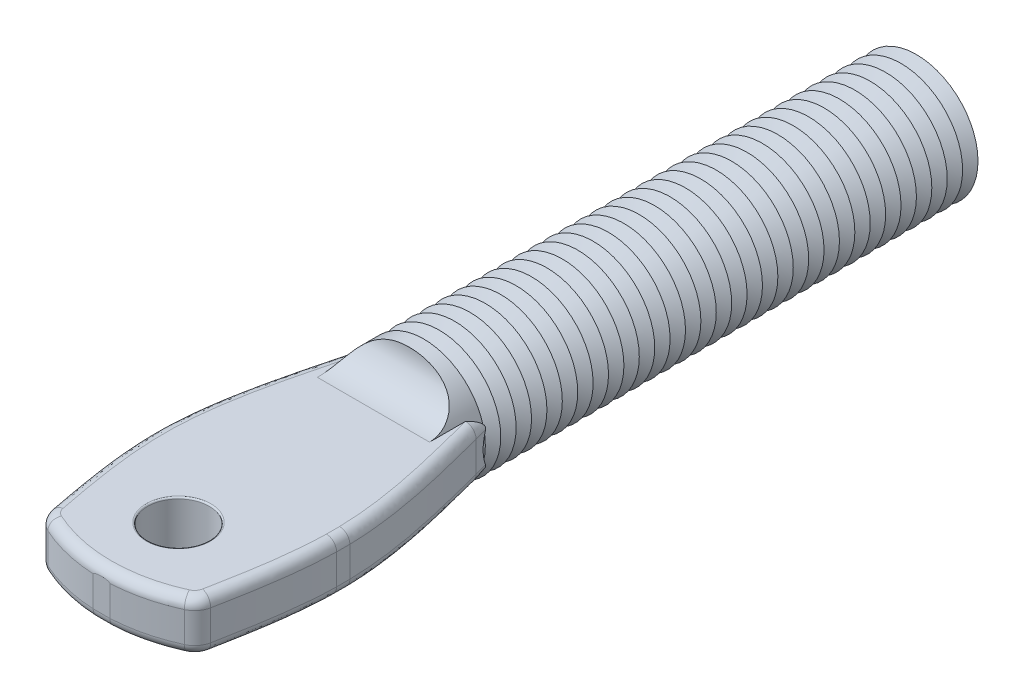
SolidWorks part; units mm, degrees
ref_plane "Front Plane" through (0, 0, 0) normal (0, 0, 1) x (1, 0, 0)
ref_plane "Top Plane" through (0, 0, 0) normal (0, 1, 0) x (1, 0, 0)
ref_plane "Right Plane" through (0, 0, 0) normal (1, 0, 0) x (0, 0, -1)
sketch "Sketch1" plane through (0, 0, 0) normal (0, 1, 0) x (1, 0, 0)
  line L0 (-9.2, 15) -> (9.2, -15) construction
  line L1 (-9.2, 15) -> (9.2, 15)
  line L2 (-9.2, 15) -> (-9.2, -15)
  line L3 (-9.2, -15) -> (9.2, -15)
  line L4 (9.2, 15) -> (9.2, -15)
  dimension "D1" = 18.4
  dimension "D2" = 30
extrude "Boss-Extrude1" add sketch "Sketch1" along normal blind 4.95
sketch "Sketch2" plane through (0, 4.95, 0) normal (0, 1, 0) x (1, 0, 0)
  line L0 (0, 15) -> (0, -15) construction
  line L1 (9.2, 15) -> (-9.2, 15) construction
  line L2 (-9.2, -15) -> (9.2, -15) construction
  line L3 (11.4859, -15) -> (7.225, -15)
  line L4 (-9.2, 15) -> (-9.2, -15) construction
  line L5 (-6.5, 15) -> (-11.4859, 15)
  line L6 (-11.4859, 15) -> (-11.4859, -15)
  line L7 (-11.4859, -15) -> (-7.225, -15)
  line L8 (11.4859, 15) -> (11.4859, -15)
  line L9 (6.5, 15) -> (11.4859, 15)
  spline S0 degree 3 poles (-6.5, 15) (-7.7391, 10.1392) (-10.4438, 0.0554) (-8.1698, -10.087) (-7.225, -15) knots 0 0 0 0 0.502016 1 1 1 1
  spline S1 degree 3 poles (6.5, 15) (7.7391, 10.1392) (10.4438, 0.0554) (8.1698, -10.087) (7.225, -15) knots 0 0 0 0 0.502016 1 1 1 1
extrude "Cut-Extrude1" cut sketch "Sketch2" against normal blind 4.95
sketch "Sketch3" plane through (0, 4.95, 0) normal (0, 1, 0) x (1, 0, 0)
  line L0 (-7.5936, -13.1091) -> (-7.5936, -16.4029)
  line L1 (-7.5936, -16.4029) -> (7.5936, -16.4029)
  line L2 (7.5936, -16.4029) -> (7.5936, -13.1091)
  arc A0 (-7.5936, -13.1091) -> (7.5936, -13.1091) centre (0, 1.0202) ccw
  spline S0 degree 3 poles (-7.225, -15) (-8.0889, -10.5076) (-9.1097, -5.9001) (-9.2, -1.2938) knots 0 0 0 0 0.455349 0.455349 0.455349 0.455349 construction
  spline S1 degree 3 poles (9.2, -1.2938) (9.1097, -5.9001) (8.0889, -10.5076) (7.225, -15) knots 0.544651 0.544651 0.544651 0.544651 1 1 1 1 construction
extrude "Cut-Extrude2" cut sketch "Sketch3" against normal blind 4.95
sketch "Sketch4" plane through (0, 0, -15) normal (0, 0, -1) x (-1, 0, 0)
  line L0 (0, 4.95) -> (0, 0) construction
  line L1 (-6.5, 4.95) -> (6.5, 4.95) construction
  circle A0 centre (0, 2.475) radius 6
  dimension "D1" = 12
extrude "Boss-Extrude2" add sketch "Sketch4" along normal blind 50
fillet "Fillet1" radius 1 8 edges at (4.3059, 0, 14.4316) (4.3059, 4.95, 14.4316)
fillet "Fillet2" radius 2 6 edges at (7.429, 4.5295, 12.9873) (7.429, 0.4205, 12.9873) (-7.333, 4.6571, 12.916) (-7.429, 0.4205, 12.9873) (-7.5936, 2.475, 13.1091) (7.5936, 2.475, 13.1091)
sketch "Sketch9" plane through (0, 0, -15) normal (0, 0, -1) x (-1, 0, 0)
  line L3 (5.4657, 0) -> (5.468, 0)
  line L4 (6.5, 1) -> (6.5, 3.95)
  line L5 (5.468, 4.95) -> (5.4657, 4.95)
  line L6 (5.4657, 0) -> (5.468, 0)
  line L7 (6.5, 1) -> (6.5, 3.95)
  line L8 (5.468, 4.95) -> (5.4657, 4.95)
  arc A1 (5.4657, 0) -> (5.4657, 4.95) centre (0, 2.475) ccw
  arc A2 (5.4657, 0) -> (5.4657, 4.95) centre (0, 2.475) ccw
  spline S2 degree 3 poles (2769.8589, 1152.2258) (-69.6047, 166.6854) (-4.7349, -4.1112) (5.9817, 0.123) (6.0956, 0.1955) (12.667, 6.4591) (-67.2021, 101.1798) (-1766.1792, -2416.4243) knots -21.101957 -21.101957 -21.101957 -21.101957 0.25 0.25 0.5 0.5 17.347125 17.347125 17.347125 17.347125 only from (5.468, 0) to (6.5, 1)
  spline S3 degree 3 poles (-1416.5643, 2641.4156) (-117.4769, -64.9249) (10.2527, -4.4883) (6.3662, 4.4598) (6.288, 4.571) (6.0965, 4.7538) (5.9816, 4.8269) (-2.4912, 8.1829) (-58.0534, -95.05) (2803.1848, -1072.1812) knots -17.84645 -17.84645 -17.84645 -17.84645 0.25 0.25 0.5 0.5 0.75 0.75 17.711935 17.711935 17.711935 17.711935 only from (6.5, 3.95) to (5.468, 4.95)
  spline S4 degree 3 poles (5.468, 0) (5.6022, 0) (5.7336, 0.025) (5.9817, 0.123) (6.0956, 0.1955) (6.3839, 0.4703) (6.5, 0.7314) (6.5, 1) knots 0 0 0 0 0.25 0.25 0.5 0.5 1 1 1 1
  spline S5 degree 3 poles (6.5, 3.95) (6.5, 4.0842) (6.4721, 4.216) (6.3662, 4.4598) (6.288, 4.571) (6.0965, 4.7538) (5.9816, 4.8269) (5.7354, 4.9244) (5.6021, 4.95) (5.468, 4.95) knots 0 0 0 0 0.25 0.25 0.5 0.5 0.75 0.75 1 1 1 1
  dimension "D1" = 0
extrude "Boss-Extrude3" add sketch "Sketch9" along normal blind 1.5 draft 15 separate body
sketch "Sketch10" plane through (0, 0, -15) normal (0, 0, -1) x (-1, 0, 0)
  line L3 (-5.4657, 4.95) -> (-5.468, 4.95)
  line L4 (-6.5, 3.95) -> (-6.5, 1)
  line L5 (-5.468, 0) -> (-5.4657, 0)
  line L6 (-5.4657, 4.95) -> (-5.468, 4.95)
  line L7 (-6.5, 3.95) -> (-6.5, 1)
  line L8 (-5.468, 0) -> (-5.4657, 0)
  arc A1 (-5.4657, 4.95) -> (-5.4657, 0) centre (0, 2.475) ccw
  arc A2 (-5.4657, 4.95) -> (-5.4657, 0) centre (0, 2.475) ccw
  spline S2 degree 3 poles (-2769.8589, -1147.2758) (69.6047, -161.7354) (4.7349, 9.0612) (-5.9817, 4.827) (-6.0956, 4.7545) (-12.667, -1.5091) (67.2021, -96.2298) (1766.1792, 2421.3743) knots -21.101957 -21.101957 -21.101957 -21.101957 0.25 0.25 0.5 0.5 17.347125 17.347125 17.347125 17.347125 only from (-5.468, 4.95) to (-6.5, 3.95)
  spline S3 degree 3 poles (1416.5643, -2636.4656) (117.4769, 69.8749) (-10.2527, 9.4383) (-6.3662, 0.4902) (-6.288, 0.379) (-6.0965, 0.1962) (-5.9816, 0.1231) (2.4912, -3.2329) (58.0534, 100) (-2803.1848, 1077.1312) knots -17.84645 -17.84645 -17.84645 -17.84645 0.25 0.25 0.5 0.5 0.75 0.75 17.711935 17.711935 17.711935 17.711935 only from (-6.5, 1) to (-5.468, 0)
  spline S4 degree 3 poles (-5.468, 4.95) (-5.6022, 4.95) (-5.7336, 4.925) (-5.9817, 4.827) (-6.0956, 4.7545) (-6.3839, 4.4797) (-6.5, 4.2186) (-6.5, 3.95) knots 0 0 0 0 0.25 0.25 0.5 0.5 1 1 1 1
  spline S5 degree 3 poles (-6.5, 1) (-6.5, 0.8658) (-6.4721, 0.734) (-6.3662, 0.4902) (-6.288, 0.379) (-6.0965, 0.1962) (-5.9816, 0.1231) (-5.7354, 0.0256) (-5.6021, 0) (-5.468, 0) knots 0 0 0 0 0.25 0.25 0.5 0.5 0.75 0.75 1 1 1 1
  dimension "D1" = 0
extrude "Boss-Extrude4" add sketch "Sketch10" along normal blind 1.5 draft 15
fillet "Fillet3" radius 3.5 2 edges
sketch "Sketch6" plane through (0, 0, 0) normal (1, 0, 0) x (0, 0, -1)
  line L0 (15, 2.475) -> (23.9396, 2.475) construction
  line L1 (15, 0) -> (15, 4.95) construction
  line L2 (16.4, 8.475) -> (17.9, 8.475)
  line L4 (65, 8.475) -> (15, 8.475) construction
  line L5 (17.9, 8.475) -> (17.15, 7.3697)
  line L6 (17.15, 7.3697) -> (16.4, 8.475)
  dimension "D1" = 1.5
  dimension "D2" = 1.4
revolve "Cut-Revolve1" cut sketch "Sketch6" angle 360 about L0
sketch "Sketch8" plane through (0, 4.95, 0) normal (0, 1, 0) x (1, 0, 0)
  line L0 (0, 0) -> (0, -9.1351) construction
  line L1 (-0.8081, -15) -> (0.8081, -15) construction
  circle A0 centre (0, -7.5) radius 3
  dimension "D1" = 6
  dimension "D2" = 7.5
extrude "Cut-Extrude3" cut sketch "Sketch8" against normal blind 4.95
fillet "Fillet4" radius 0.15 2 edges at (0, 4.95, 10.5) (0, 0, 10.5)
chamfer "Chamfer1" distance 0.5 angle 45 1 edges at (-6, 2.475, -65)
sketch "Sketch7" plane through (0, 0, 0) normal (1, 0, 0) x (0, 0, -1)
  line L0 (16.4, 2.475) -> (21.0836, 2.475)
  line L1 (16.4, 8.475) -> (16.4, -3.525) construction
pattern_linear "LPattern1" count 33 spacing 1.5 along (0, 0, -1) of "Cut-Revolve1"
